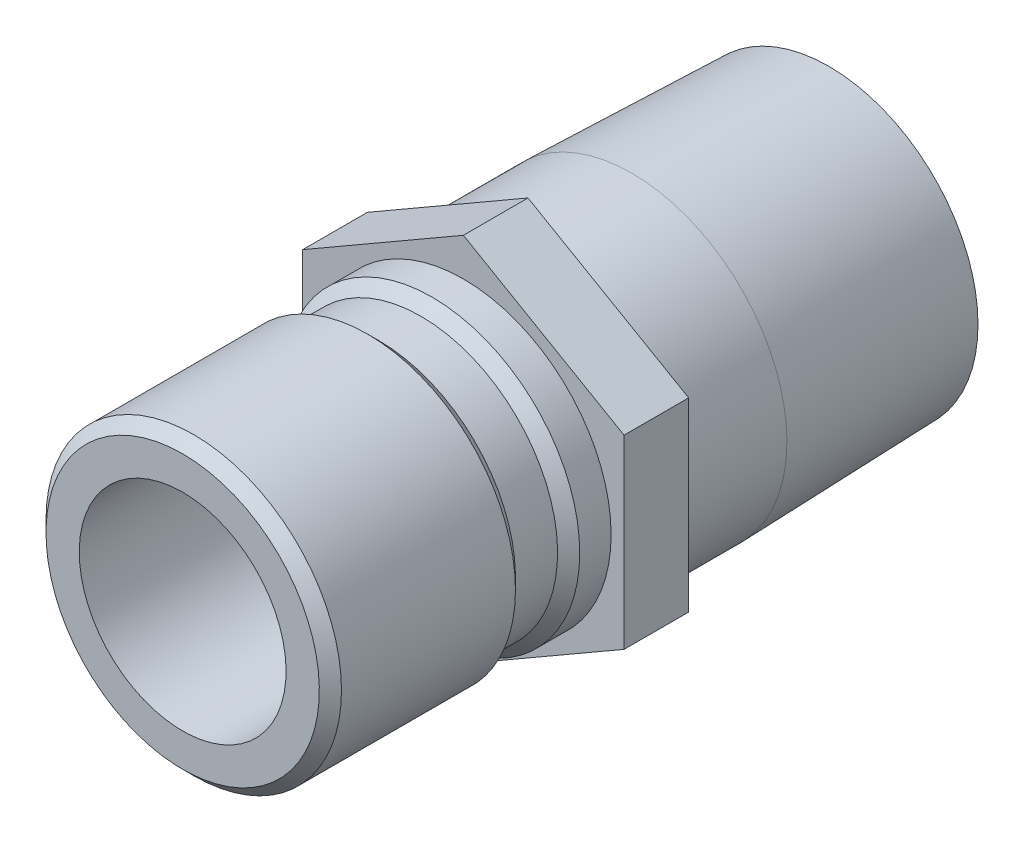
SolidWorks part; units mm, degrees
ref_plane "Front Plane" through (0, 0, 0) normal (0, 0, 1) x (1, 0, 0)
ref_plane "Top Plane" through (0, 0, 0) normal (0, 1, 0) x (1, 0, 0)
ref_plane "Right Plane" through (0, 0, 0) normal (1, 0, 0) x (0, 0, -1)
sketch "Sketch1" plane through (0, 0, 0) normal (1, 0, 0) x (0, 0, -1)
  line L0 (0, 0) -> (-22.479, 0) construction
  line L1 (-19.304, 7.112) -> (-19.304, 9.398)
  line L2 (-5.8166, 9.398) -> (-5.8166, 0) construction
  line L3 (-18.542, 10.16) -> (-6.5786, 10.16)
  line L4 (0, 10.668) -> (0, 0) construction
  line L5 (-5.8166, 9.398) -> (-2.921, 9.398)
  line L6 (-2.159, 10.16) -> (0, 10.16)
  line L7 (0, 10.16) -> (0, 10.668)
  line L8 (-5.8166, 9.398) -> (-6.5786, 10.16)
  line L9 (-2.921, 9.398) -> (-2.159, 10.16)
  line L10 (-19.304, 9.398) -> (-18.542, 10.16)
  line L11 (-1.1053, 7.8994) -> (25.146, 7.8994)
  line L12 (0, 10.668) -> (11.5824, 10.668)
  line L13 (11.5824, 10.668) -> (25.146, 10.2441)
  line L14 (25.146, 10.2441) -> (25.146, 7.8994)
  line L15 (4.445, 0) -> (0, 0) construction
  line L16 (-19.304, 7.112) -> (-1.524, 7.112)
  line L17 (-1.524, 7.112) -> (-1.1053, 7.8994)
  dimension "D1" = 19.304
  dimension "D2" = 2.8956
  dimension "D3" = 0.762
  dimension "D4" = 45
  dimension "D5" = 13.4874
  dimension "D6" = 45
  dimension "D7" = 1.79
  dimension "D8" = 13.5636
  dimension "D9" = 44.45
  dimension "D10" = 3.175
  dimension "D11" = 4.445
  dimension "D12" = 15.7988
  dimension "D13" = 21.336
  dimension "D14" = 20.32
  dimension "D15" = 118
  dimension "D16" = 14.224
  dimension "D17" = 17.78
revolve "Revolve1" add sketch "Sketch1" angle 360 about L0
sketch "Sketch2" plane through (0, 0, 0) normal (0, 0, 1) x (1, 0, 0)
  line L1 (-11.049, 6.3791) -> (-11.049, -6.3791)
  line L2 (-11.049, -6.3791) -> (0, -12.7583)
  line L3 (0, -12.7583) -> (11.049, -6.3791)
  line L4 (11.049, -6.3791) -> (11.049, 6.3791)
  line L5 (11.049, 6.3791) -> (0, 12.7583)
  line L6 (0, 12.7583) -> (-11.049, 6.3791)
  circle A0 centre (0, 0) radius 11.049 construction
  circle A1 centre (0, 0) radius 7.8994 construction
  circle A2 centre (0, 0) radius 7.8994
  dimension "D1" = 22.098
extrude "Boss-Extrude1" add sketch "Sketch2" against normal up to vertex (4.445 mm away)
